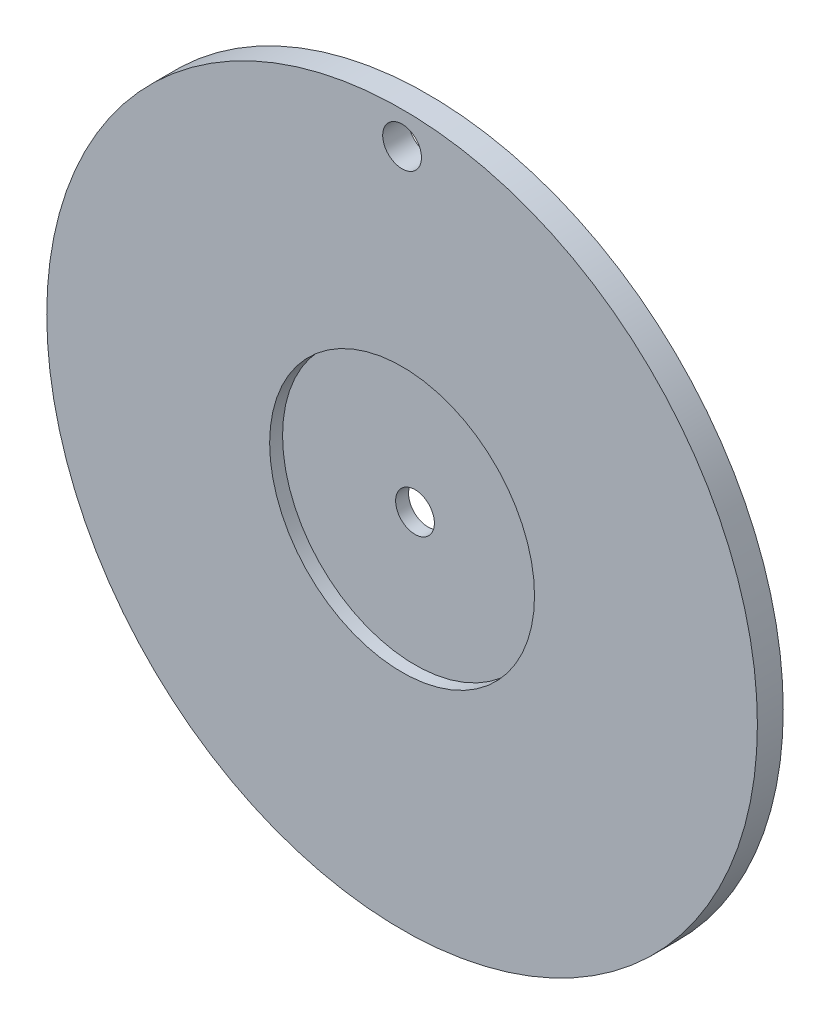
SolidWorks part; units mm, degrees
ref_plane "Ebene vorne" through (0, 0, 0) normal (0, 0, 1) x (1, 0, 0)
ref_plane "Ebene oben" through (0, 0, 0) normal (0, 1, 0) x (1, 0, 0)
ref_plane "Ebene rechts" through (0, 0, 0) normal (1, 0, 0) x (0, 0, -1)
sketch "Skizze1" plane through (0, 0, 0) normal (0, 0, 1) x (1, 0, 0)
  circle A0 centre (0, 0) radius 25 construction
  circle A1 centre (0, 25) radius 1.5
  circle A2 centre (0, 0) radius 27.5
  dimension "D1" = 50
  dimension "D2" = 3
  dimension "D3" = 55
extrude "Aufsatz-Linear austragen2" add sketch "Skizze1" along normal blind 2 contours A2 | A1
sketch "Skizze3" plane through (0, 0, 2) normal (0, 0, 1) x (1, 0, 0)
  circle A0 centre (0, 0) radius 10.25
  dimension "D1" = 20.5
extrude "Schnitt-Linear austragen1" cut sketch "Skizze3" against normal blind 1
sketch "Skizze5" plane through (0, 0, 1) normal (0, 0, 1) x (1, 0, 0)
  circle A0 centre (0, 0) radius 1.5
  dimension "D1" = 3
extrude "Schnitt-Linear austragen2" cut sketch "Skizze5" against normal blind 9
